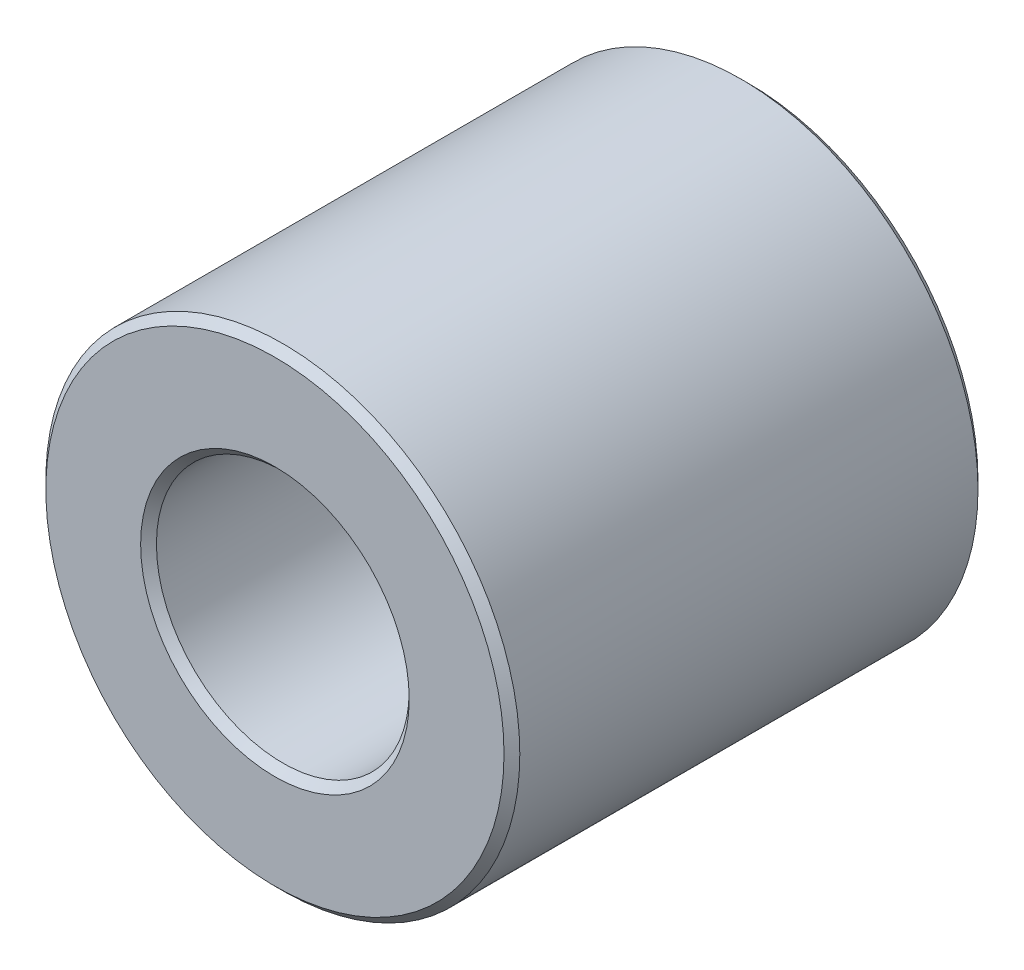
SolidWorks part; units mm, degrees
ref_plane "Front Plane" through (0, 0, 0) normal (0, 0, 1) x (1, 0, 0)
ref_plane "Top Plane" through (0, 0, 0) normal (0, 1, 0) x (1, 0, 0)
ref_plane "Right Plane" through (0, 0, 0) normal (1, 0, 0) x (0, 0, -1)
sketch "Sketch1" plane through (0, 0, 0) normal (0, 0, 1) x (1, 0, 0)
  circle A0 centre (0, 0) radius 3
  circle A1 centre (0, 0) radius 1.6
  dimension "D1" = 6
  dimension "D2" = 3.2
extrude "Boss-Extrude2" add sketch "Sketch1" along normal mid plane 6
chamfer "Chamfer3" distance 0.1 angle 45 4 edges at (3, 0, 3) (3, 0, -3) (1.6, 0, -3) (1.6, 0, 3)
